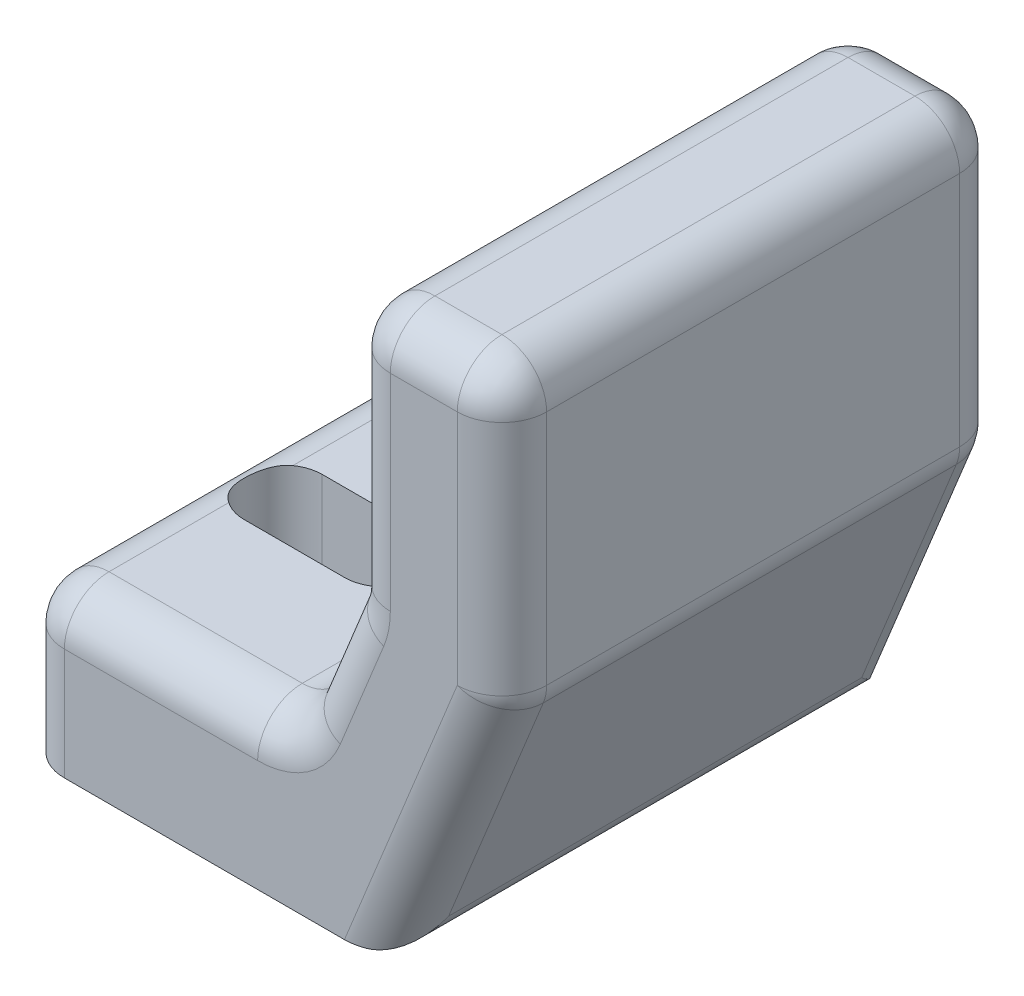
SolidWorks part; units mm, degrees
ref_plane "Ebene vorne" through (0, 0, 0) normal (0, 0, 1) x (1, 0, 0)
ref_plane "Ebene oben" through (0, 0, 0) normal (0, 1, 0) x (1, 0, 0)
ref_plane "Ebene rechts" through (0, 0, 0) normal (1, 0, 0) x (0, 0, -1)
sketch "Skizze1" plane through (0, 0, 0) normal (0, 0, 1) x (1, 0, 0)
  line L0 (0, 0) -> (16.7043, 0)
  line L1 (16.7043, 0) -> (21.6, 12)
  line L2 (21.6, 12) -> (21.6, 25)
  line L3 (21.6, 25) -> (14.6, 25)
  line L4 (14.6, 25) -> (14.6, 13.373)
  line L5 (14.6, 13.373) -> (12, 7)
  line L6 (12, 7) -> (0, 7)
  line L7 (0, 7) -> (0, 0)
  dimension "D1" = 21.6
  dimension "D2" = 25
  dimension "D3" = 12
  dimension "D4" = 12
  dimension "D5" = 7
  dimension "D6" = 7
  dimension "D7" = 7
extrude "Aufsatz-Linear austragen1" add sketch "Skizze1" along normal blind 22.5
sketch "Skizze2" plane through (0, 7, 0) normal (0, 1, 0) x (1, 0, 0)
  line L0 (3, -13.7) -> (7.5, -13.7) construction
  line L1 (3, -11.95) -> (7.5, -11.95)
  line L2 (3, -15.45) -> (7.5, -15.45)
  line L3 (0, -22.5) -> (0, 0) construction
  line L4 (12, -22.5) -> (0, -22.5) construction
  arc A0 (3, -11.95) -> (3, -15.45) centre (3, -13.7) ccw
  arc A1 (7.5, -15.45) -> (7.5, -11.95) centre (7.5, -13.7) ccw
  point P2 (5.25, -13.7)
  dimension "D1" = 3.5
  dimension "D2" = 3
  dimension "D3" = 4.5
  dimension "D4" = 8.8
extrude "Schnitt-Linear austragen1" cut sketch "Skizze2" against normal up to surface (7 mm away) contours L1 A1 L2 A0
fillet "Verrundung1" radius 2 21 edges at (14.6, 19.1865, 0) (14.6, 19.1865, 22.5) (13.3, 10.1865, 0) (13.3, 10.1865, 22.5) (21.6, 12, 11.25) (21.6, 18.5, 22.5) (21.6, 25, 11.25) (21.6, 18.5, 0) (0, 7, 11.25) (6, 7, 0) (6, 7, 22.5) (19.1522, 6, 22.5) (19.1522, 6, 0) (16.7043, 0, 11.25) (14.6, 25, 11.25) (14.6, 13.373, 11.25) (12, 7, 11.25) (0, 3.5, 22.5) (0, 3.5, 0) (18.1, 25, 22.5) (18.1, 25, 0)
